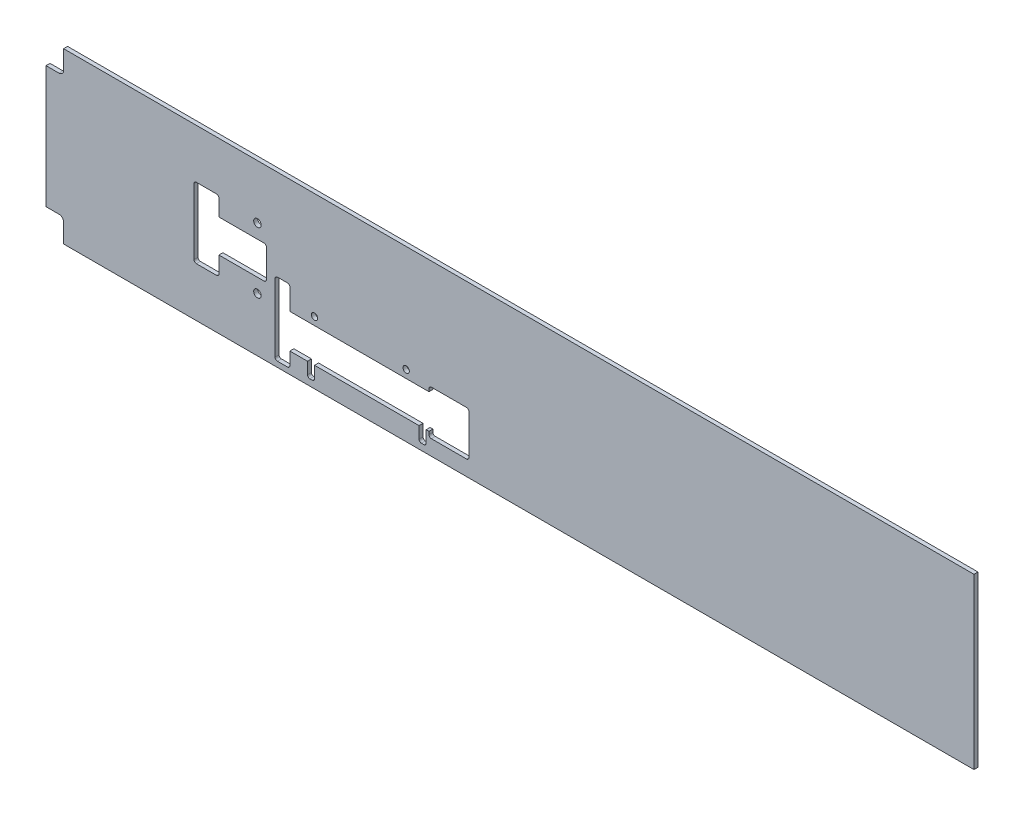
SolidWorks part; units mm, degrees
ref_plane "Plan1" through (0, 0, 0) normal (0, 0, 1) x (1, 0, 0)
ref_plane "Plan2" through (0, 0, 0) normal (0, 1, 0) x (1, 0, 0)
ref_plane "Plan3" through (0, 0, 0) normal (1, 0, 0) x (0, 0, -1)
sketch "Esquisse1" plane through (0, 0, 0) normal (0, 0, 1) x (1, 0, 0)
  line L0 (0, -30) -> (0, 46) construction
  line L1 (50, 0) -> (-48, 0) construction
  line L2 (-197.5, 26) -> (-192, 26)
  line L3 (-190, 36) -> (197.5, 36)
  line L4 (-197.5, 26) -> (-197.5, -26)
  line L5 (-190, -36) -> (197.5, -36)
  line L6 (197.5, 36) -> (197.5, -36)
  line L7 (-190, 28) -> (-190, 36)
  line L8 (-197.5, -26) -> (-192, -26)
  line L9 (-190, -28) -> (-190, -36)
  arc A0 (-192, 26) -> (-190, 28) centre (-192, 28) ccw
  arc A1 (-192, -26) -> (-190, -28) centre (-192, -28) cw
  dimension "D3" = 2
  dimension "D1" = 7.5
  dimension "D2" = 10
  dimension "D4" = 395
  dimension "D5" = 72
extrude "Plaque" add sketch "Esquisse1" along normal blind 1.7
sketch "Esquisse2" plane through (0, 0, 1.7) normal (0, 0, 1) x (1, 0, 0)
  line L0 (0, 0) -> (-205, 0) construction
  line L1 (-123.9, -7) -> (-123.9, -14)
  line L2 (-133.5, 15) -> (-124.9, 15)
  line L3 (-134.5, 14) -> (-134.5, -14)
  line L4 (-133.5, -15) -> (-124.9, -15)
  line L5 (-123.9, 14) -> (-123.9, 7)
  line L6 (-123.9, 7) -> (-104.7, 7)
  line L7 (-197.5, 26) -> (-197.5, -26) construction
  line L8 (-123.9, -7) -> (-104.7, -7)
  line L9 (-103.7, 6) -> (-103.7, -6)
  arc A0 (-134.5, 14) -> (-133.5, 15) centre (-133.5, 14) cw
  arc A1 (-123.9, 14) -> (-124.9, 15) centre (-124.9, 14) ccw
  arc A2 (-124.9, -15) -> (-123.9, -14) centre (-124.9, -14) ccw
  arc A3 (-134.5, -14) -> (-133.5, -15) centre (-133.5, -14) ccw
  arc A4 (-103.7, 6) -> (-104.7, 7) centre (-104.7, 6) ccw
  arc A5 (-104.7, -7) -> (-103.7, -6) centre (-104.7, -6) ccw
  dimension "D6" = 1
  dimension "D1" = 10.6
  dimension "D2" = 30.8
  dimension "D3" = 30
  dimension "D4" = 14
  dimension "D5" = 63
extrude "Lumière moteur" cut sketch "Esquisse2" against normal through all
sketch "Esquisse3" plane through (0, 0, 1.7) normal (0, 0, 1) x (1, 0, 0)
  line L0 (0, 0) -> (-152, 0) construction
  line L1 (-197.5, 26) -> (-197.5, -26) construction
  circle A0 centre (-107.5, 13) radius 1.6
  circle A1 centre (-107.5, -13) radius 1.6
  dimension "D1" = 3.2
  dimension "D2" = 90
  dimension "D3" = 26
extrude "Perçage fixation plaque" cut sketch "Esquisse3" against normal through all
sketch "Esquisse4" plane through (0, 0, 1.7) normal (0, 0, 1) x (1, 0, 0)
  line L0 (0, -20) -> (-104, -20) construction
  line L1 (-35.7, -27.3) -> (-34.5, -27.3)
  line L2 (-93.7, -12.7) -> (-34.5, -12.7)
  line L3 (-93.7, -12.7) -> (-93.7, -3.7)
  line L4 (-93.7, -27.3) -> (-86.2, -27.3)
  line L5 (-197.5, 26) -> (-197.5, -26) construction
  line L6 (-33.5, -10.5) -> (-18.5, -10.5)
  line L7 (-34.5, -11.5) -> (-34.5, -12.7)
  line L8 (-33.5, -29.5) -> (-18.5, -29.5)
  line L9 (-17.5, -11.5) -> (-17.5, -28.5)
  line L10 (-83.2, -27.3) -> (-38.7, -27.3)
  line L11 (-34.5, -27.3) -> (-34.5, -28.5)
  line L12 (-38.7, -27.3) -> (-38.7, -32.3)
  line L13 (-37.7, -33.3) -> (-36.7, -33.3)
  line L14 (-35.7, -27.3) -> (-35.7, -32.3)
  line L16 (-86.2, -27.3) -> (-86.2, -32.3)
  line L17 (-85.2, -33.3) -> (-84.2, -33.3)
  line L18 (-83.2, -27.3) -> (-83.2, -32.3)
  line L19 (-94.7, -33.7) -> (-99, -33.7)
  line L20 (-93.7, -32.7) -> (-93.7, -27.3)
  line L21 (-94.7, -2.7) -> (-99, -2.7)
  line L22 (-100, -32.7) -> (-100, -3.7)
  arc A0 (-86.2, -32.3) -> (-85.2, -33.3) centre (-85.2, -32.3) ccw
  arc A1 (-84.2, -33.3) -> (-83.2, -32.3) centre (-84.2, -32.3) ccw
  arc A2 (-94.7, -33.7) -> (-93.7, -32.7) centre (-94.7, -32.7) ccw
  arc A3 (-100, -32.7) -> (-99, -33.7) centre (-99, -32.7) ccw
  arc A4 (-99, -2.7) -> (-100, -3.7) centre (-99, -3.7) ccw
  arc A5 (-93.7, -3.7) -> (-94.7, -2.7) centre (-94.7, -3.7) ccw
  arc A6 (-33.5, -10.5) -> (-34.5, -11.5) centre (-33.5, -11.5) ccw
  arc A7 (-17.5, -11.5) -> (-18.5, -10.5) centre (-18.5, -11.5) ccw
  arc A8 (-18.5, -29.5) -> (-17.5, -28.5) centre (-18.5, -28.5) ccw
  arc A9 (-34.5, -28.5) -> (-33.5, -29.5) centre (-33.5, -28.5) ccw
  arc A10 (-36.7, -33.3) -> (-35.7, -32.3) centre (-36.7, -32.3) ccw
  arc A11 (-38.7, -32.3) -> (-37.7, -33.3) centre (-37.7, -32.3) ccw
  dimension "D7" = 1
  dimension "D1" = 14.6
  dimension "D2" = 20
  dimension "D3" = 6.3
  dimension "D4" = 10
  dimension "D5" = 31
  dimension "D6" = 7.5
  dimension "D8" = 6
  dimension "D9" = 3
  dimension "D10" = 55
  dimension "D11" = 19
  dimension "D12" = 17
  dimension "D13" = 65.5
  dimension "D14" = 97.5
  dimension "D15" = 3
  dimension "D16" = 6
extrude "Lumière capteur" cut sketch "Esquisse4" against normal through all
sketch "Esquisse5" plane through (0, 0, 1.7) normal (0, 0, 1) x (1, 0, 0)
  line L0 (-36.2, -9.35) -> (-88.2, -9.35) construction
  line L1 (-34.5, -12.7) -> (-93.7, -12.7) construction
  line L2 (-93.7, -12.7) -> (-93.7, -3.7) construction
  circle A0 centre (-44.2, -9.35) radius 1.35
  circle A1 centre (-83.2, -9.35) radius 1.35
  dimension "D1" = 2.7
  dimension "D2" = 2.7
  dimension "D3" = 3.35
  dimension "D4" = 39
  dimension "D5" = 10.5
extrude "perçage fixation capteur" cut sketch "Esquisse5" against normal through all
